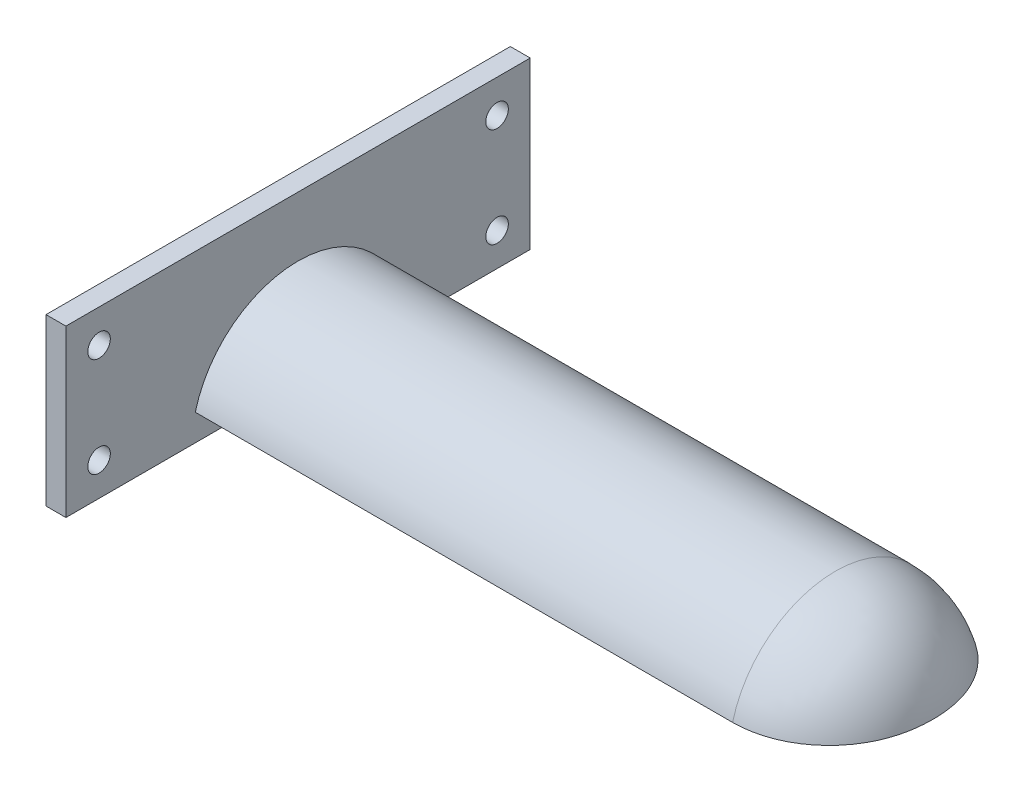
SolidWorks part; units mm, degrees
ref_plane "Front Plane" through (0, 0, 0) normal (0, 0, 1) x (1, 0, 0)
ref_plane "Top Plane" through (0, 0, 0) normal (0, 1, 0) x (1, 0, 0)
ref_plane "Right Plane" through (0, 0, 0) normal (1, 0, 0) x (0, 0, -1)
sketch "Sketch1" plane through (0, 0, 0) normal (1, 0, 0) x (0, 0, -1)
  line L0 (-20, 0) -> (20, 0) construction
  line L1 (-15.4919, 4) -> (15.4919, 4)
  arc A0 (-20, 0) -> (20, 0) centre (0, 0) cw construction
  arc A1 (-15.4919, 4) -> (15.4919, 4) centre (0, 0) cw
  point P4 (0, 0)
  dimension "D1" = 40
  dimension "D2" = 4
extrude "Boss-Extrude1" add sketch "Sketch1" along normal blind 96
fillet "Fillet1" radius 15 1 edges at (96, 16, 0)
sketch "Sketch2" plane through (0, 0, 0) normal (-1, 0, 0) x (0, 0, 1)
  line L1 (35, 0) -> (-35, 0)
  line L2 (35, 0) -> (35, 25)
  line L3 (35, 25) -> (-35, 25)
  line L4 (-35, 0) -> (-35, 25)
  line L5 (15.4919, 4) -> (-15.4919, 4) construction
  point P4 (0, 0)
  dimension "D1" = 70
  dimension "D2" = 4
  dimension "D3" = 25
extrude "Boss-Extrude2" add sketch "Sketch2" along normal blind 3
sketch "Sketch3" plane through (-3, 0, 0) normal (-1, 0, 0) x (0, 0, 1)
  line L0 (-35, 0) -> (35, 0) construction
  line L1 (35, 0) -> (35, 25) construction
  circle A0 centre (30, 5) radius 1.7
  dimension "D1" = 3.4
  dimension "D2" = 5
  dimension "D3" = 5
extrude "Cut-Extrude1" cut sketch "Sketch3" against normal through all
pattern_linear "LPattern1" count 2 spacing 60 along (0, 0, -1) count 2 spacing 15 along (0, 1, 0) of "Cut-Extrude1"
